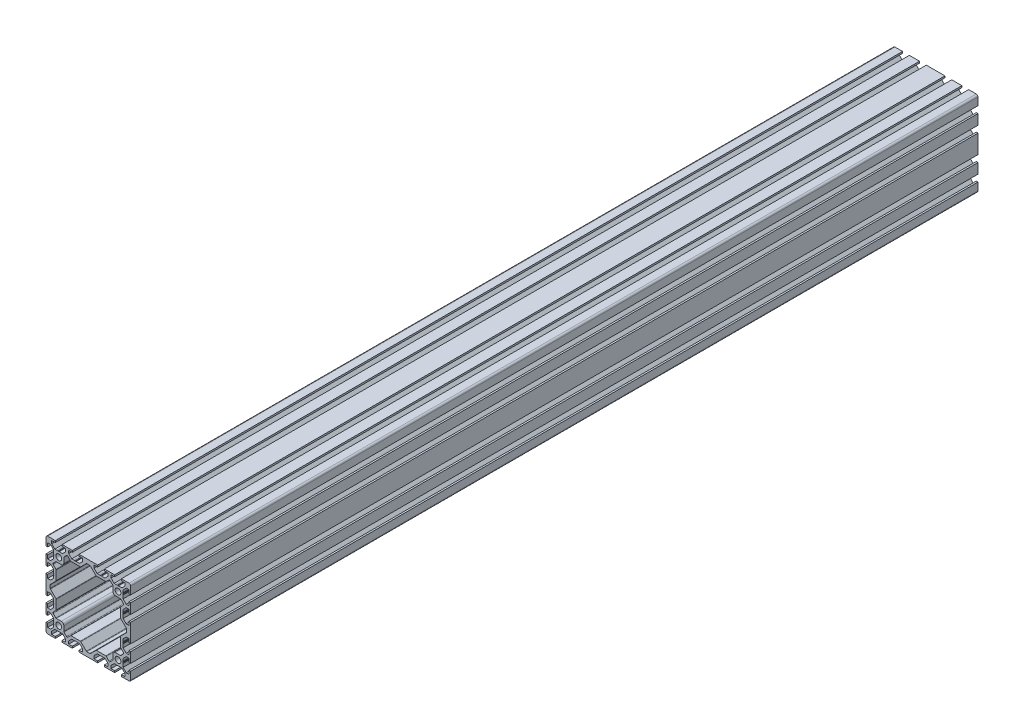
SolidWorks part; units mm, degrees
ref_plane "Plan de face" through (0, 0, 0) normal (0, 0, 1) x (1, 0, 0)
ref_plane "Plan de dessus" through (0, 0, 0) normal (0, 1, 0) x (1, 0, 0)
ref_plane "Plan de droite" through (0, 0, 0) normal (1, 0, 0) x (0, 0, -1)
sketch "Model" plane through (0, 0, 0) normal (0, 0, 1) x (1, 0, 0)
  line L0 (31.43, -35) -> (38.57, -35) construction
  line L1 (35, -38.57) -> (35, -31.43) construction
  line L2 (31.43, 35) -> (38.57, 35) construction
  line L3 (35, 31.43) -> (35, 38.57) construction
  line L4 (-38.57, 35) -> (-31.43, 35) construction
  line L5 (-35, 31.43) -> (-35, 38.57) construction
  line L6 (-38.57, -35) -> (-31.43, -35) construction
  line L7 (-35, -38.57) -> (-35, -31.43) construction
  line L8 (-45, 1.7574) -> (-45, -1.7574)
  line L9 (-38.2929, 8.8787) -> (-44.7071, 2.4645)
  line L10 (-38, 20.4142) -> (-38, 9.5858)
  line L11 (-41.4645, 24.2929) -> (-38.2929, 21.1213)
  line L12 (-38.4645, 28.7071) -> (-41.4645, 25.7071)
  line L13 (-32, 29) -> (-37.7574, 29)
  line L14 (-29, 37.7574) -> (-29, 32)
  line L15 (-25.7071, 41.4645) -> (-28.7071, 38.4645)
  line L16 (-21.1213, 38.2929) -> (-24.2929, 41.4645)
  line L17 (-9.5858, 38) -> (-20.4142, 38)
  line L18 (-2.4645, 44.7071) -> (-8.8787, 38.2929)
  line L19 (1.7574, 45) -> (-1.7574, 45)
  line L20 (8.8787, 38.2929) -> (2.4645, 44.7071)
  line L21 (20.4142, 38) -> (9.5858, 38)
  line L22 (24.2929, 41.4645) -> (21.1213, 38.2929)
  line L23 (28.7071, 38.4645) -> (25.7071, 41.4645)
  line L24 (29, 32) -> (29, 37.7574)
  line L25 (37.7574, 29) -> (32, 29)
  line L26 (41.4645, 25.7071) -> (38.4645, 28.7071)
  line L27 (38.2929, 21.1213) -> (41.4645, 24.2929)
  line L28 (38, 9.5858) -> (38, 20.4142)
  line L29 (44.7071, 2.4645) -> (38.2929, 8.8787)
  line L30 (45, -1.7574) -> (45, 1.7574)
  line L31 (38.2929, -8.8787) -> (44.7071, -2.4645)
  line L32 (38, -20.4142) -> (38, -9.5858)
  line L33 (41.4645, -24.2929) -> (38.2929, -21.1213)
  line L34 (38.4645, -28.7071) -> (41.4645, -25.7071)
  line L35 (32, -29) -> (37.7574, -29)
  line L36 (29, -37.7574) -> (29, -32)
  line L37 (25.7071, -41.4645) -> (28.7071, -38.4645)
  line L38 (21.1213, -38.2929) -> (24.2929, -41.4645)
  line L39 (9.5858, -38) -> (20.4142, -38)
  line L40 (2.4645, -44.7071) -> (8.8787, -38.2929)
  line L41 (-1.7574, -45) -> (1.7574, -45)
  line L42 (-8.8787, -38.2929) -> (-2.4645, -44.7071)
  line L43 (-20.4142, -38) -> (-9.5858, -38)
  line L44 (-24.2929, -41.4645) -> (-21.1213, -38.2929)
  line L45 (-28.7071, -38.4645) -> (-25.7071, -41.4645)
  line L46 (-29, -32) -> (-29, -37.7574)
  line L47 (-37.7574, -29) -> (-32, -29)
  line L48 (-41.4645, -25.7071) -> (-38.4645, -28.7071)
  line L49 (-38.2929, -21.1213) -> (-41.4645, -24.2929)
  line L50 (-38, -9.5858) -> (-38, -20.4142)
  line L51 (-44.7071, -2.4645) -> (-38.2929, -8.8787)
  line L52 (-50, 11) -> (-50, -11)
  line L53 (-50, -11) -> (-48, -11)
  line L54 (-48, -11) -> (-48, -6.75)
  line L55 (-48, -6.75) -> (-44.6642, -6.75)
  line L56 (-44.6642, -6.75) -> (-41, -10.4142)
  line L57 (-41, -10.4142) -> (-41, -14.3464)
  line L58 (-40.933, -14.5964) -> (-40.7, -15)
  line L59 (-40.7, -15) -> (-40.933, -15.4036)
  line L60 (-40.933, -15.9036) -> (-40.751, -16.2189)
  line L61 (-40.751, -16.2189) -> (-41, -17.5)
  line L62 (-41, -17.5) -> (-41, -19.5858)
  line L63 (-41, -19.5858) -> (-44.6642, -23.25)
  line L64 (-44.6642, -23.25) -> (-48, -23.25)
  line L65 (-48, -23.25) -> (-48, -19)
  line L66 (-48, -19) -> (-50, -19)
  line L67 (-50, -19) -> (-50, -31)
  line L68 (-50, -31) -> (-48, -31)
  line L69 (-48, -31) -> (-48, -26.75)
  line L70 (-48, -26.75) -> (-44.6642, -26.75)
  line L71 (-44.6642, -26.75) -> (-41, -30.4142)
  line L72 (-41, -30.4142) -> (-41, -34.3464)
  line L73 (-40.933, -34.5964) -> (-40.7, -35)
  line L74 (-40.7, -35) -> (-40.933, -35.4036)
  line L75 (-40.933, -35.9036) -> (-40.751, -36.2189)
  line L76 (-40.751, -36.2189) -> (-41, -37.5)
  line L77 (-41, -37.5) -> (-41, -39.5858)
  line L78 (-41, -39.5858) -> (-44.6642, -43.25)
  line L79 (-44.6642, -43.25) -> (-48, -43.25)
  line L80 (-48, -43.25) -> (-48, -39)
  line L81 (-48, -39) -> (-50, -39)
  line L82 (-50, -39) -> (-50, -48)
  line L83 (-48, -50) -> (-39, -50)
  line L84 (-39, -50) -> (-39, -48)
  line L85 (-39, -48) -> (-43.25, -48)
  line L86 (-43.25, -48) -> (-43.25, -44.6642)
  line L87 (-43.25, -44.6642) -> (-39.5858, -41)
  line L88 (-39.5858, -41) -> (-35.6536, -41)
  line L89 (-35.4036, -40.933) -> (-35, -40.7)
  line L90 (-35, -40.7) -> (-34.5964, -40.933)
  line L91 (-34.0964, -40.933) -> (-33.7811, -40.751)
  line L92 (-33.7811, -40.751) -> (-32.5, -41)
  line L93 (-32.5, -41) -> (-30.4142, -41)
  line L94 (-30.4142, -41) -> (-26.75, -44.6642)
  line L95 (-26.75, -44.6642) -> (-26.75, -48)
  line L96 (-26.75, -48) -> (-31, -48)
  line L97 (-31, -48) -> (-31, -50)
  line L98 (-31, -50) -> (-19, -50)
  line L99 (-19, -50) -> (-19, -48)
  line L100 (-19, -48) -> (-23.25, -48)
  line L101 (-23.25, -48) -> (-23.25, -44.6642)
  line L102 (-23.25, -44.6642) -> (-19.5858, -41)
  line L103 (-19.5858, -41) -> (-15.6536, -41)
  line L104 (-15.4036, -40.933) -> (-15, -40.7)
  line L105 (-15, -40.7) -> (-14.5964, -40.933)
  line L106 (-14.0964, -40.933) -> (-13.7811, -40.751)
  line L107 (-13.7811, -40.751) -> (-12.5, -41)
  line L108 (-12.5, -41) -> (-10.4142, -41)
  line L109 (-10.4142, -41) -> (-6.75, -44.6642)
  line L110 (-6.75, -44.6642) -> (-6.75, -48)
  line L111 (-6.75, -48) -> (-11, -48)
  line L112 (-11, -48) -> (-11, -50)
  line L113 (-11, -50) -> (11, -50)
  line L114 (11, -50) -> (11, -48)
  line L115 (11, -48) -> (6.75, -48)
  line L116 (6.75, -48) -> (6.75, -44.6642)
  line L117 (6.75, -44.6642) -> (10.4142, -41)
  line L118 (10.4142, -41) -> (14.3464, -41)
  line L119 (14.5964, -40.933) -> (15, -40.7)
  line L120 (15, -40.7) -> (15.4036, -40.933)
  line L121 (15.9036, -40.933) -> (16.2189, -40.751)
  line L122 (16.2189, -40.751) -> (17.5, -41)
  line L123 (17.5, -41) -> (19.5858, -41)
  line L124 (19.5858, -41) -> (23.25, -44.6642)
  line L125 (23.25, -44.6642) -> (23.25, -48)
  line L126 (23.25, -48) -> (19, -48)
  line L127 (19, -48) -> (19, -50)
  line L128 (19, -50) -> (31, -50)
  line L129 (31, -50) -> (31, -48)
  line L130 (31, -48) -> (26.75, -48)
  line L131 (26.75, -48) -> (26.75, -44.6642)
  line L132 (26.75, -44.6642) -> (30.4142, -41)
  line L133 (30.4142, -41) -> (34.3464, -41)
  line L134 (34.5964, -40.933) -> (35, -40.7)
  line L135 (35, -40.7) -> (35.4036, -40.933)
  line L136 (35.9036, -40.933) -> (36.2189, -40.751)
  line L137 (36.2189, -40.751) -> (37.5, -41)
  line L138 (37.5, -41) -> (39.5858, -41)
  line L139 (39.5858, -41) -> (43.25, -44.6642)
  line L140 (43.25, -44.6642) -> (43.25, -48)
  line L141 (43.25, -48) -> (39, -48)
  line L142 (39, -48) -> (39, -50)
  line L143 (39, -50) -> (48, -50)
  line L144 (50, -48) -> (50, -39)
  line L145 (50, -39) -> (48, -39)
  line L146 (48, -39) -> (48, -43.25)
  line L147 (48, -43.25) -> (44.6642, -43.25)
  line L148 (44.6642, -43.25) -> (41, -39.5858)
  line L149 (41, -39.5858) -> (41, -35.6536)
  line L150 (40.933, -35.4036) -> (40.7, -35)
  line L151 (40.7, -35) -> (40.933, -34.5964)
  line L152 (40.933, -34.0964) -> (40.751, -33.7811)
  line L153 (40.751, -33.7811) -> (41, -32.5)
  line L154 (41, -32.5) -> (41, -30.4142)
  line L155 (41, -30.4142) -> (44.6642, -26.75)
  line L156 (44.6642, -26.75) -> (48, -26.75)
  line L157 (48, -26.75) -> (48, -31)
  line L158 (48, -31) -> (50, -31)
  line L159 (50, -31) -> (50, -19)
  line L160 (50, -19) -> (48, -19)
  line L161 (48, -19) -> (48, -23.25)
  line L162 (48, -23.25) -> (44.6642, -23.25)
  line L163 (44.6642, -23.25) -> (41, -19.5858)
  line L164 (41, -19.5858) -> (41, -15.6536)
  line L165 (40.933, -15.4036) -> (40.7, -15)
  line L166 (40.7, -15) -> (40.933, -14.5964)
  line L167 (40.933, -14.0964) -> (40.751, -13.7811)
  line L168 (40.751, -13.7811) -> (41, -12.5)
  line L169 (41, -12.5) -> (41, -10.4142)
  line L170 (41, -10.4142) -> (44.6642, -6.75)
  line L171 (44.6642, -6.75) -> (48, -6.75)
  line L172 (48, -6.75) -> (48, -11)
  line L173 (48, -11) -> (50, -11)
  line L174 (50, -11) -> (50, 11)
  line L175 (50, 11) -> (48, 11)
  line L176 (48, 11) -> (48, 6.75)
  line L177 (48, 6.75) -> (44.6642, 6.75)
  line L178 (44.6642, 6.75) -> (41, 10.4142)
  line L179 (41, 10.4142) -> (41, 14.3464)
  line L180 (40.933, 14.5964) -> (40.7, 15)
  line L181 (40.7, 15) -> (40.933, 15.4036)
  line L182 (40.933, 15.9036) -> (40.751, 16.2189)
  line L183 (40.751, 16.2189) -> (41, 17.5)
  line L184 (41, 17.5) -> (41, 19.5858)
  line L185 (41, 19.5858) -> (44.6642, 23.25)
  line L186 (44.6642, 23.25) -> (48, 23.25)
  line L187 (48, 23.25) -> (48, 19)
  line L188 (48, 19) -> (50, 19)
  line L189 (50, 19) -> (50, 31)
  line L190 (50, 31) -> (48, 31)
  line L191 (48, 31) -> (48, 26.75)
  line L192 (48, 26.75) -> (44.6642, 26.75)
  line L193 (44.6642, 26.75) -> (41, 30.4142)
  line L194 (41, 30.4142) -> (41, 34.3464)
  line L195 (40.933, 34.5964) -> (40.7, 35)
  line L196 (40.7, 35) -> (40.933, 35.4036)
  line L197 (40.933, 35.9036) -> (40.751, 36.2189)
  line L198 (40.751, 36.2189) -> (41, 37.5)
  line L199 (41, 37.5) -> (41, 39.5858)
  line L200 (41, 39.5858) -> (44.6642, 43.25)
  line L201 (44.6642, 43.25) -> (48, 43.25)
  line L202 (48, 43.25) -> (48, 39)
  line L203 (48, 39) -> (50, 39)
  line L204 (50, 39) -> (50, 48)
  line L205 (48, 50) -> (39, 50)
  line L206 (39, 50) -> (39, 48)
  line L207 (39, 48) -> (43.25, 48)
  line L208 (43.25, 48) -> (43.25, 44.6642)
  line L209 (43.25, 44.6642) -> (39.5858, 41)
  line L210 (39.5858, 41) -> (35.6536, 41)
  line L211 (35.4036, 40.933) -> (35, 40.7)
  line L212 (35, 40.7) -> (34.5964, 40.933)
  line L213 (34.0964, 40.933) -> (33.7811, 40.751)
  line L214 (33.7811, 40.751) -> (32.5, 41)
  line L215 (32.5, 41) -> (30.4142, 41)
  line L216 (30.4142, 41) -> (26.75, 44.6642)
  line L217 (26.75, 44.6642) -> (26.75, 48)
  line L218 (26.75, 48) -> (31, 48)
  line L219 (31, 48) -> (31, 50)
  line L220 (31, 50) -> (19, 50)
  line L221 (19, 50) -> (19, 48)
  line L222 (19, 48) -> (23.25, 48)
  line L223 (23.25, 48) -> (23.25, 44.6642)
  line L224 (23.25, 44.6642) -> (19.5858, 41)
  line L225 (19.5858, 41) -> (15.6536, 41)
  line L226 (15.4036, 40.933) -> (15, 40.7)
  line L227 (15, 40.7) -> (14.5964, 40.933)
  line L228 (14.0964, 40.933) -> (13.7811, 40.751)
  line L229 (13.7811, 40.751) -> (12.5, 41)
  line L230 (12.5, 41) -> (10.4142, 41)
  line L231 (10.4142, 41) -> (6.75, 44.6642)
  line L232 (6.75, 44.6642) -> (6.75, 48)
  line L233 (6.75, 48) -> (11, 48)
  line L234 (11, 48) -> (11, 50)
  line L235 (11, 50) -> (-11, 50)
  line L236 (-11, 50) -> (-11, 48)
  line L237 (-11, 48) -> (-6.75, 48)
  line L238 (-6.75, 48) -> (-6.75, 44.6642)
  line L239 (-6.75, 44.6642) -> (-10.4142, 41)
  line L240 (-10.4142, 41) -> (-14.3464, 41)
  line L241 (-14.5964, 40.933) -> (-15, 40.7)
  line L242 (-15, 40.7) -> (-15.4036, 40.933)
  line L243 (-15.9036, 40.933) -> (-16.2189, 40.751)
  line L244 (-16.2189, 40.751) -> (-17.5, 41)
  line L245 (-17.5, 41) -> (-19.5858, 41)
  line L246 (-19.5858, 41) -> (-23.25, 44.6642)
  line L247 (-23.25, 44.6642) -> (-23.25, 48)
  line L248 (-23.25, 48) -> (-19, 48)
  line L249 (-19, 48) -> (-19, 50)
  line L250 (-19, 50) -> (-31, 50)
  line L251 (-31, 50) -> (-31, 48)
  line L252 (-31, 48) -> (-26.75, 48)
  line L253 (-26.75, 48) -> (-26.75, 44.6642)
  line L254 (-26.75, 44.6642) -> (-30.4142, 41)
  line L255 (-30.4142, 41) -> (-34.3464, 41)
  line L256 (-34.5964, 40.933) -> (-35, 40.7)
  line L257 (-35, 40.7) -> (-35.4036, 40.933)
  line L258 (-35.9036, 40.933) -> (-36.2189, 40.751)
  line L259 (-36.2189, 40.751) -> (-37.5, 41)
  line L260 (-37.5, 41) -> (-39.5858, 41)
  line L261 (-39.5858, 41) -> (-43.25, 44.6642)
  line L262 (-43.25, 44.6642) -> (-43.25, 48)
  line L263 (-43.25, 48) -> (-39, 48)
  line L264 (-39, 48) -> (-39, 50)
  line L265 (-39, 50) -> (-48, 50)
  line L266 (-50, 48) -> (-50, 39)
  line L267 (-50, 39) -> (-48, 39)
  line L268 (-48, 39) -> (-48, 43.25)
  line L269 (-48, 43.25) -> (-44.6642, 43.25)
  line L270 (-44.6642, 43.25) -> (-41, 39.5858)
  line L271 (-41, 39.5858) -> (-41, 35.6536)
  line L272 (-40.933, 35.4036) -> (-40.7, 35)
  line L273 (-40.7, 35) -> (-40.933, 34.5964)
  line L274 (-40.933, 34.0964) -> (-40.751, 33.7811)
  line L275 (-40.751, 33.7811) -> (-41, 32.5)
  line L276 (-41, 32.5) -> (-41, 30.4142)
  line L277 (-41, 30.4142) -> (-44.6642, 26.75)
  line L278 (-44.6642, 26.75) -> (-48, 26.75)
  line L279 (-48, 26.75) -> (-48, 31)
  line L280 (-48, 31) -> (-50, 31)
  line L281 (-50, 31) -> (-50, 19)
  line L282 (-50, 19) -> (-48, 19)
  line L283 (-48, 19) -> (-48, 23.25)
  line L284 (-48, 23.25) -> (-44.6642, 23.25)
  line L285 (-44.6642, 23.25) -> (-41, 19.5858)
  line L286 (-41, 19.5858) -> (-41, 15.6536)
  line L287 (-40.933, 15.4036) -> (-40.7, 15)
  line L288 (-40.7, 15) -> (-40.933, 14.5964)
  line L289 (-40.933, 14.0964) -> (-40.751, 13.7811)
  line L290 (-40.751, 13.7811) -> (-41, 12.5)
  line L291 (-41, 12.5) -> (-41, 10.4142)
  line L292 (-41, 10.4142) -> (-44.6642, 6.75)
  line L293 (-44.6642, 6.75) -> (-48, 6.75)
  line L294 (-48, 6.75) -> (-48, 11)
  line L295 (-48, 11) -> (-50, 11)
  arc A0 (34.5964, 40.933) -> (34.0964, 40.933) centre (34.3464, 40.5) ccw
  circle A1 centre (35, -35) radius 3.4
  circle A2 centre (35, 35) radius 3.4
  arc A3 (-44.7071, 2.4645) -> (-45, 1.7574) centre (-44, 1.7574) ccw
  arc A4 (-38.2929, 8.8787) -> (-38, 9.5858) centre (-39, 9.5858) ccw
  arc A5 (-38, 20.4142) -> (-38.2929, 21.1213) centre (-39, 20.4142) ccw
  arc A6 (-41.4645, 25.7071) -> (-41.4645, 24.2929) centre (-40.7574, 25) ccw
  arc A7 (-37.7574, 29) -> (-38.4645, 28.7071) centre (-37.7574, 28) ccw
  arc A8 (-32, 29) -> (-29, 32) centre (-32, 32) ccw
  arc A9 (-28.7071, 38.4645) -> (-29, 37.7574) centre (-28, 37.7574) ccw
  arc A10 (-24.2929, 41.4645) -> (-25.7071, 41.4645) centre (-25, 40.7574) ccw
  arc A11 (-21.1213, 38.2929) -> (-20.4142, 38) centre (-20.4142, 39) ccw
  arc A12 (-9.5858, 38) -> (-8.8787, 38.2929) centre (-9.5858, 39) ccw
  arc A13 (-1.7574, 45) -> (-2.4645, 44.7071) centre (-1.7574, 44) ccw
  arc A14 (2.4645, 44.7071) -> (1.7574, 45) centre (1.7574, 44) ccw
  arc A15 (8.8787, 38.2929) -> (9.5858, 38) centre (9.5858, 39) ccw
  arc A16 (20.4142, 38) -> (21.1213, 38.2929) centre (20.4142, 39) ccw
  arc A17 (25.7071, 41.4645) -> (24.2929, 41.4645) centre (25, 40.7574) ccw
  arc A18 (29, 37.7574) -> (28.7071, 38.4645) centre (28, 37.7574) ccw
  arc A19 (29, 32) -> (32, 29) centre (32, 32) ccw
  arc A20 (38.4645, 28.7071) -> (37.7574, 29) centre (37.7574, 28) ccw
  arc A21 (41.4645, 24.2929) -> (41.4645, 25.7071) centre (40.7574, 25) ccw
  arc A22 (38.2929, 21.1213) -> (38, 20.4142) centre (39, 20.4142) ccw
  arc A23 (38, 9.5858) -> (38.2929, 8.8787) centre (39, 9.5858) ccw
  arc A24 (45, 1.7574) -> (44.7071, 2.4645) centre (44, 1.7574) ccw
  arc A25 (44.7071, -2.4645) -> (45, -1.7574) centre (44, -1.7574) ccw
  arc A26 (38.2929, -8.8787) -> (38, -9.5858) centre (39, -9.5858) ccw
  arc A27 (38, -20.4142) -> (38.2929, -21.1213) centre (39, -20.4142) ccw
  arc A28 (41.4645, -25.7071) -> (41.4645, -24.2929) centre (40.7574, -25) ccw
  arc A29 (37.7574, -29) -> (38.4645, -28.7071) centre (37.7574, -28) ccw
  arc A30 (32, -29) -> (29, -32) centre (32, -32) ccw
  arc A31 (28.7071, -38.4645) -> (29, -37.7574) centre (28, -37.7574) ccw
  arc A32 (24.2929, -41.4645) -> (25.7071, -41.4645) centre (25, -40.7574) ccw
  arc A33 (21.1213, -38.2929) -> (20.4142, -38) centre (20.4142, -39) ccw
  arc A34 (9.5858, -38) -> (8.8787, -38.2929) centre (9.5858, -39) ccw
  arc A35 (1.7574, -45) -> (2.4645, -44.7071) centre (1.7574, -44) ccw
  arc A36 (-2.4645, -44.7071) -> (-1.7574, -45) centre (-1.7574, -44) ccw
  arc A37 (-8.8787, -38.2929) -> (-9.5858, -38) centre (-9.5858, -39) ccw
  arc A38 (-20.4142, -38) -> (-21.1213, -38.2929) centre (-20.4142, -39) ccw
  arc A39 (-25.7071, -41.4645) -> (-24.2929, -41.4645) centre (-25, -40.7574) ccw
  arc A40 (-29, -37.7574) -> (-28.7071, -38.4645) centre (-28, -37.7574) ccw
  arc A41 (-29, -32) -> (-32, -29) centre (-32, -32) ccw
  arc A42 (-38.4645, -28.7071) -> (-37.7574, -29) centre (-37.7574, -28) ccw
  arc A43 (-41.4645, -24.2929) -> (-41.4645, -25.7071) centre (-40.7574, -25) ccw
  arc A44 (-38.2929, -21.1213) -> (-38, -20.4142) centre (-39, -20.4142) ccw
  arc A45 (-38, -9.5858) -> (-38.2929, -8.8787) centre (-39, -9.5858) ccw
  arc A46 (-45, -1.7574) -> (-44.7071, -2.4645) centre (-44, -1.7574) ccw
  arc A47 (-41, -14.3464) -> (-40.933, -14.5964) centre (-40.5, -14.3464) ccw
  arc A48 (-40.933, -15.4036) -> (-40.933, -15.9036) centre (-40.5, -15.6536) ccw
  arc A49 (-41, -34.3464) -> (-40.933, -34.5964) centre (-40.5, -34.3464) ccw
  arc A50 (-40.933, -35.4036) -> (-40.933, -35.9036) centre (-40.5, -35.6536) ccw
  arc A51 (-50, -48) -> (-48, -50) centre (-48, -48) ccw
  arc A52 (-35.6536, -41) -> (-35.4036, -40.933) centre (-35.6536, -40.5) ccw
  arc A53 (-34.5964, -40.933) -> (-34.0964, -40.933) centre (-34.3464, -40.5) ccw
  arc A54 (-15.6536, -41) -> (-15.4036, -40.933) centre (-15.6536, -40.5) ccw
  arc A55 (-14.5964, -40.933) -> (-14.0964, -40.933) centre (-14.3464, -40.5) ccw
  arc A56 (14.3464, -41) -> (14.5964, -40.933) centre (14.3464, -40.5) ccw
  arc A57 (15.4036, -40.933) -> (15.9036, -40.933) centre (15.6536, -40.5) ccw
  arc A58 (34.3464, -41) -> (34.5964, -40.933) centre (34.3464, -40.5) ccw
  arc A59 (35.4036, -40.933) -> (35.9036, -40.933) centre (35.6536, -40.5) ccw
  arc A60 (48, -50) -> (50, -48) centre (48, -48) ccw
  arc A61 (41, -35.6536) -> (40.933, -35.4036) centre (40.5, -35.6536) ccw
  arc A62 (40.933, -34.5964) -> (40.933, -34.0964) centre (40.5, -34.3464) ccw
  arc A63 (41, -15.6536) -> (40.933, -15.4036) centre (40.5, -15.6536) ccw
  arc A64 (40.933, -14.5964) -> (40.933, -14.0964) centre (40.5, -14.3464) ccw
  arc A65 (41, 14.3464) -> (40.933, 14.5964) centre (40.5, 14.3464) ccw
  arc A66 (40.933, 15.4036) -> (40.933, 15.9036) centre (40.5, 15.6536) ccw
  arc A67 (41, 34.3464) -> (40.933, 34.5964) centre (40.5, 34.3464) ccw
  arc A68 (40.933, 35.4036) -> (40.933, 35.9036) centre (40.5, 35.6536) ccw
  arc A69 (50, 48) -> (48, 50) centre (48, 48) ccw
  arc A70 (35.6536, 41) -> (35.4036, 40.933) centre (35.6536, 40.5) ccw
  arc A71 (15.6536, 41) -> (15.4036, 40.933) centre (15.6536, 40.5) ccw
  arc A72 (14.5964, 40.933) -> (14.0964, 40.933) centre (14.3464, 40.5) ccw
  arc A73 (-14.3464, 41) -> (-14.5964, 40.933) centre (-14.3464, 40.5) ccw
  arc A74 (-15.4036, 40.933) -> (-15.9036, 40.933) centre (-15.6536, 40.5) ccw
  arc A75 (-34.3464, 41) -> (-34.5964, 40.933) centre (-34.3464, 40.5) ccw
  arc A76 (-35.4036, 40.933) -> (-35.9036, 40.933) centre (-35.6536, 40.5) ccw
  arc A77 (-48, 50) -> (-50, 48) centre (-48, 48) ccw
  arc A78 (-41, 35.6536) -> (-40.933, 35.4036) centre (-40.5, 35.6536) ccw
  arc A79 (-40.933, 34.5964) -> (-40.933, 34.0964) centre (-40.5, 34.3464) ccw
  arc A80 (-41, 15.6536) -> (-40.933, 15.4036) centre (-40.5, 15.6536) ccw
  arc A81 (-40.933, 14.5964) -> (-40.933, 14.0964) centre (-40.5, 14.3464) ccw
  circle A82 centre (-35, 35) radius 3.4
  circle A83 centre (-35, -35) radius 3.4
extrude "Boss.-Extru.1" add sketch "Model" along normal blind 1000
